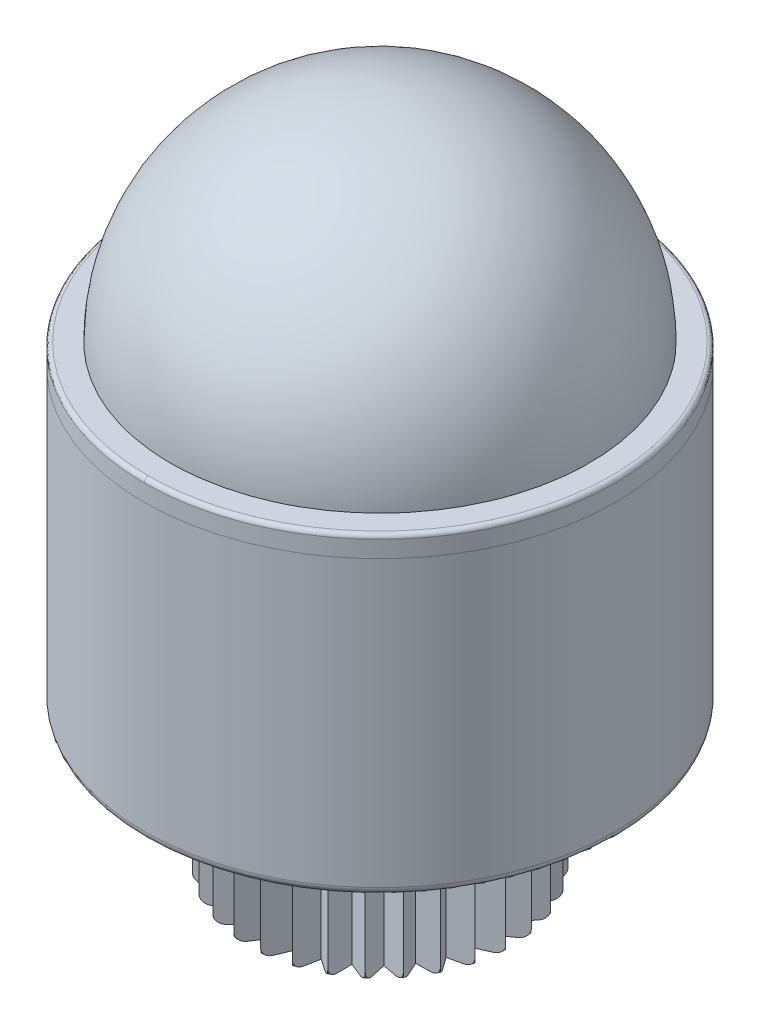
SolidWorks part; units mm, degrees
ref_plane "Plan de face" through (0, 0, 0) normal (0, 0, 1) x (1, 0, 0)
ref_plane "Plan de dessus" through (0, 0, 0) normal (0, 1, 0) x (1, 0, 0)
ref_plane "Plan de droite" through (0, 0, 0) normal (1, 0, 0) x (0, 0, -1)
imported_body "Importée1"
imported_body "Importée2"
sketch "Esquisse1" plane through (0, 0, 0) normal (0, 0, 1) x (1, 0, 0)
  line L0 (-4.5772, -7) -> (-3.8776, -7) construction
  line L1 (-42.6999, -7) -> (15.8471, -7)
  line L2 (-42.6999, -7) -> (-42.6999, -34.4984)
  line L3 (-42.6999, -34.4984) -> (15.8471, -34.4984)
  line L4 (15.8471, -7) -> (15.8471, -34.4984)
extrude "Extrusion1" cut sketch "Esquisse1" along normal mid plane 40
